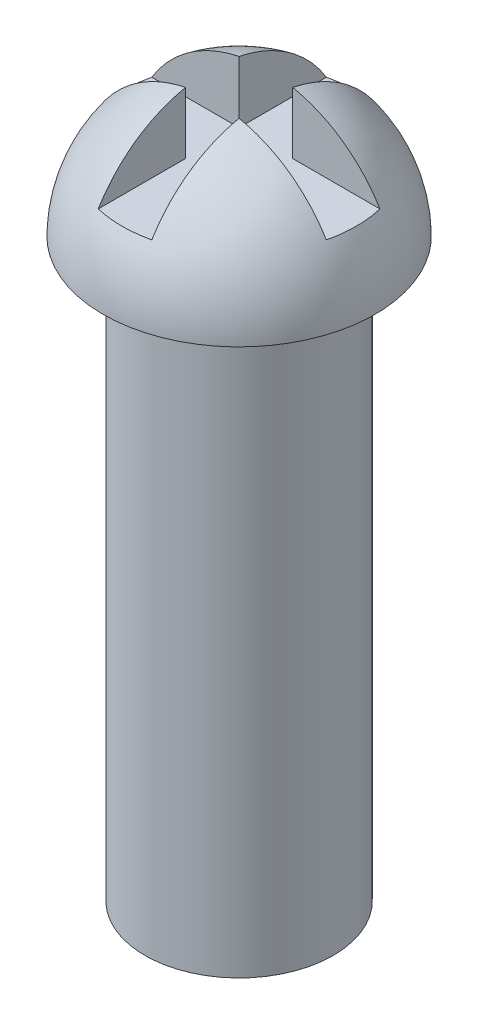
SolidWorks part; units mm, degrees
ref_plane "Front" through (0, 0, 0) normal (0, 0, 1) x (1, 0, 0)
ref_plane "Top" through (0, 0, 0) normal (0, 1, 0) x (1, 0, 0)
ref_plane "Right" through (0, 0, 0) normal (1, 0, 0) x (0, 0, -1)
sketch "Sketch1" plane through (0, 0, 0) normal (0, 0, 1) x (1, 0, 0)
  line L0 (0, 10.1105) -> (0, -21.844) construction
  line L1 (5.1562, 0) -> (3.5719, 0)
  line L2 (3.5719, 0) -> (3.5719, -21.844)
  line L3 (3.5719, -21.844) -> (0, -21.844)
  line L4 (0, -21.844) -> (0, 5.08)
  line L5 (0, 5.08) -> (-4.8734, 5.08) construction
  line L6 (50, 0) -> (-50, 0) construction
  arc A0 (0, 5.08) -> (5.1562, 0) centre (0, -0.0768) cw
  dimension "D1" = 10.3124
  dimension "D2" = 7.1437
  dimension "D3" = 26.924
  dimension "D4" = 5.08
revolve "Base-Revolve" add sketch "Sketch1" angle 360 about L0
sketch "Sketch2" plane through (0, 0, 0) normal (0, 0, 1) x (1, 0, 0)
  line L1 (-1.016, 4.9789) -> (-1.016, 2.54)
  line L2 (1.016, 2.54) -> (-1.016, 2.54)
  line L3 (1.016, 2.54) -> (1.016, 4.9789)
  line L5 (0, 2.9275) -> (0, -3.9159) construction
  line L6 (0, -21.844) -> (0, 0) construction
  arc A0 (5.1562, 0) -> (-5.1562, 0) centre (0, -0.0768) ccw construction
  arc A4 (1.016, 4.9789) -> (-1.016, 4.9789) centre (0, -0.0768) ccw
  dimension "D1" = 2.032
  dimension "D2" = 2.54
extrude "Cut-Extrude1" cut sketch "Sketch2" against normal through all and the other way through all
sketch "Sketch3" plane through (0, 2.54, 0) normal (0, 1, 0) x (-1, 0, 0)
  line L0 (5.1562, 1.016) -> (-5.1562, -1.016) construction
  line L1 (5.1562, -1.016) -> (-5.1562, -1.016)
  line L2 (5.1562, -1.016) -> (5.1562, 1.016)
  line L3 (5.1562, 1.016) -> (-5.1562, 1.016)
  line L4 (-5.1562, -1.016) -> (-5.1562, 1.016)
  circle A0 centre (0, 0) radius 5.1562 construction
  dimension "D1" = 2.032
extrude "Cut-Extrude2" cut sketch "Sketch3" along normal through all
